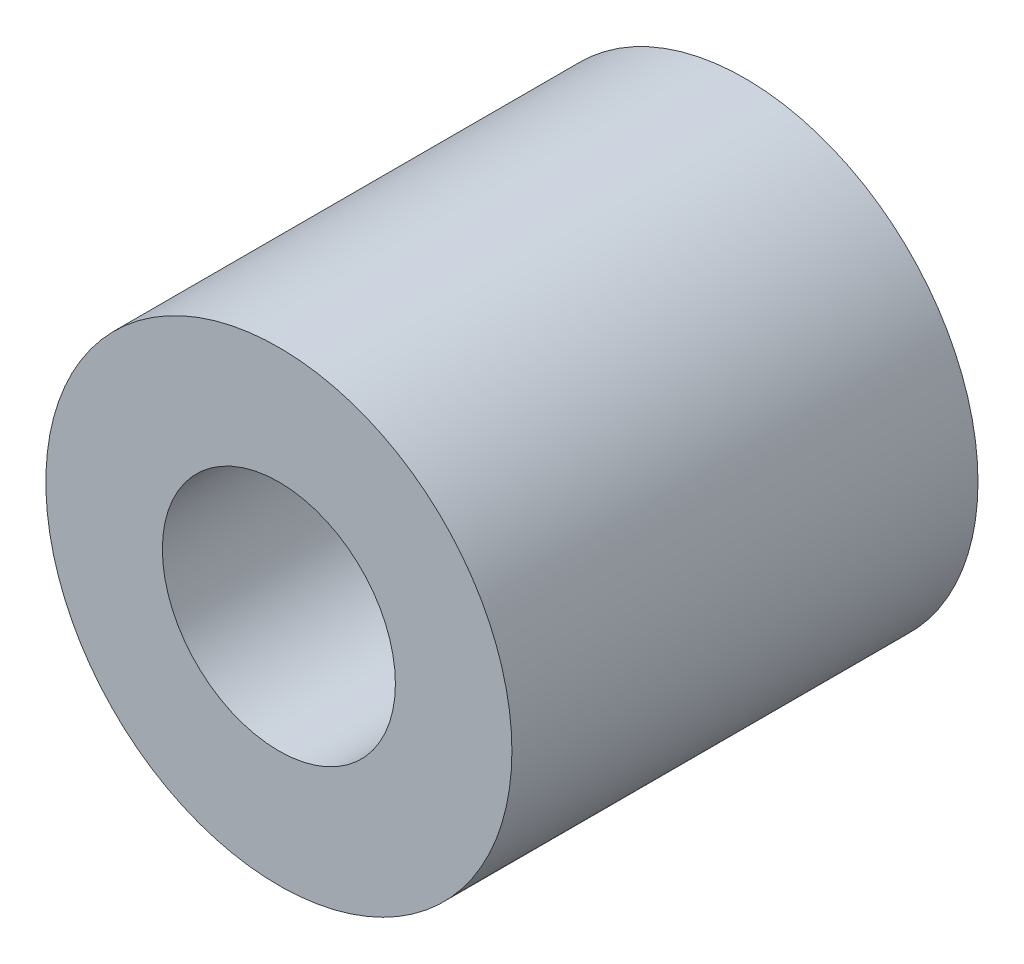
SolidWorks part; units mm, degrees
ref_plane "Plan de face" through (0, 0, 0) normal (0, 0, 1) x (1, 0, 0)
ref_plane "Plan de dessus" through (0, 0, 0) normal (0, 1, 0) x (1, 0, 0)
ref_plane "Plan de droite" through (0, 0, 0) normal (1, 0, 0) x (0, 0, -1)
sketch "Esquisse1" plane through (0, 0, 0) normal (0, 0, 1) x (1, 0, 0)
  circle A0 centre (0, 0) radius 3
  circle A1 centre (0, 0) radius 1.5
extrude "Extrusion1" add sketch "Esquisse1" along normal blind 6
